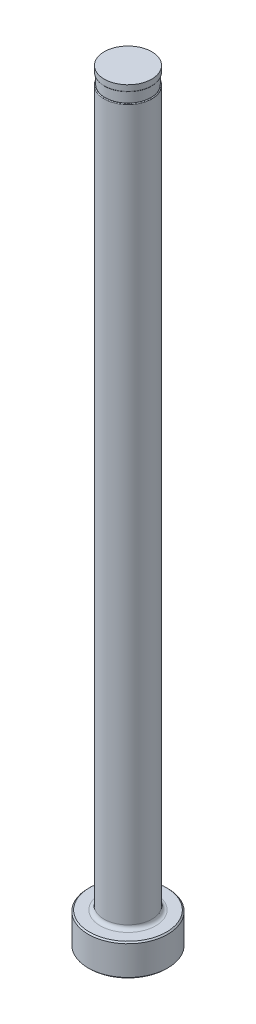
SolidWorks part; units mm, degrees
ref_plane "Front Plane" through (0, 0, 0) normal (0, 0, 1) x (1, 0, 0)
ref_plane "Top Plane" through (0, 0, 0) normal (0, 1, 0) x (1, 0, 0)
ref_plane "Right Plane" through (0, 0, 0) normal (1, 0, 0) x (0, 0, -1)
other "Configuration Table"
sketch "Sketch1" plane through (0, 0, 0) normal (0, 0, 1) x (1, 0, 0)
  line L0 (0, 259.9588) -> (0, -15.1925) construction
  line L1 (0, 0) -> (-7.9375, 0)
  line L2 (-7.9375, 0) -> (-7.9375, 6.35)
  line L3 (-7.9375, 6.35) -> (-4.7625, 6.35)
  line L4 (-4.7625, 6.35) -> (-4.7625, 152.4)
  line L5 (-4.7625, 152.4) -> (0, 152.4)
  line L6 (0, 152.4) -> (0, 0)
  dimension "L" = 152.4
  dimension "H" = 15.875
  dimension "T" = 6.35
  dimension "D" = 9.525
revolve "Revolve1" add sketch "Sketch1" angle 360 about L0
chamfer "Chamfer1" distance 0.254 angle 45 2 edges at (0, 6.35, 7.9375) (0, 0, 7.9375)
fillet "Fillet1" radius 0.762 1 edges at (0, 6.35, 4.7625)
sketch "Sketch2" plane through (0, 0, 0) normal (0, 0, 1) x (1, 0, 0)
  line L0 (-4.7625, 152.4) -> (-4.7625, 7.112) construction
  line L1 (-4.7625, 151.13) -> (-4.5593, 151.13)
  line L2 (-4.7625, 151.13) -> (-4.7625, 149.098)
  line L3 (-4.7625, 149.098) -> (-4.5593, 149.098)
  line L4 (-4.5593, 151.13) -> (-4.5593, 149.098)
  line L5 (4.7625, 152.4) -> (-4.7625, 152.4) construction
  line L6 (0, 153.4483) -> (0, 147.3282) construction
  dimension "D1" = 2.032
  dimension "N" = 1.27
  dimension "FD" = 0.2032
  dimension "D3" = 9.1186
revolve "Vent Relief" cut sketch "Sketch2" angle 360 about L6
sketch "Sketch3" plane through (0, 0, 0) normal (0, 0, 1) x (1, 0, 0)
  line L0 (-4.5593, 150.114) -> (-4.5593, 86.614)
  line L1 (-4.5593, 151.13) -> (-4.5593, 149.098) construction
  line L2 (-4.7625, 149.098) -> (-4.7625, 7.112) construction
  line L3 (-4.7625, 85.4964) -> (-4.7625, 150.114)
  line L4 (-4.7625, 150.114) -> (-4.5593, 150.114)
  arc A0 (-4.5593, 86.614) -> (-4.7625, 85.4964) centre (-7.7343, 86.614) cw
  dimension "D1" = 3.175
  dimension "D2" = 63.5
extrude "D-Slot" cut sketch "Sketch3" against normal through all both and the other way through all
sketch "Sketch5" plane through (0, 0, 0) normal (0, 0, 1) x (1, 0, 0)
  line L0 (-4.7625, 151.13) -> (4.7625, 151.13) construction
  line L1 (-4.7625, 152.4) -> (-4.7434, 152.4)
  line L2 (-4.7625, 152.4) -> (-4.7625, 151.13)
  line L3 (-4.7625, 151.13) -> (-4.7434, 151.13)
  line L4 (-4.7434, 152.4) -> (-4.7434, 151.13)
  line L5 (0, 152.6877) -> (0, 150.5771) construction
  dimension "VP" = 0.019
revolve "Vent Diameter" cut sketch "Sketch5" angle 360 about L5
fillet "Fillet2" radius 0.127 2 edges at (4.7625, 149.098, 0) (0, 151.13, 4.7434)
sketch "Pocket Sketch" plane through (0, 0, 0) normal (0, 0, 1) x (1, 0, 0)
  line L0 (-8.3344, 0) -> (-8.3344, 6.3754)
  line L1 (-8.3344, 6.3754) -> (-5.7229, 6.3754)
  line L2 (-4.9609, 7.1374) -> (-4.9609, 22.225)
  line L3 (-4.9609, 22.225) -> (0, 22.225)
  line L4 (0, 22.225) -> (0, 0)
  line L5 (0, 0) -> (-8.3344, 0)
  line L6 (0, 12.6104) -> (0, -2.4989) construction
  line L7 (-7.9375, 6.096) -> (-7.9375, 0.254) construction
  line L8 (7.6835, 6.35) -> (-7.6835, 6.35) construction
  line L9 (-4.7625, 85.4964) -> (-4.7625, 7.112) construction
  line L10 (-5.7229, 6.3754) -> (-4.9609, 7.1374)
  point P3 (-4.9609, 6.3754)
  dimension "D1" = 16.6687
  dimension "D2" = 0.3969
  dimension "D3" = 0.0254
  dimension "D4" = 0.1984
  dimension "D5" = 9.9219
  dimension "D6" = 22.225
